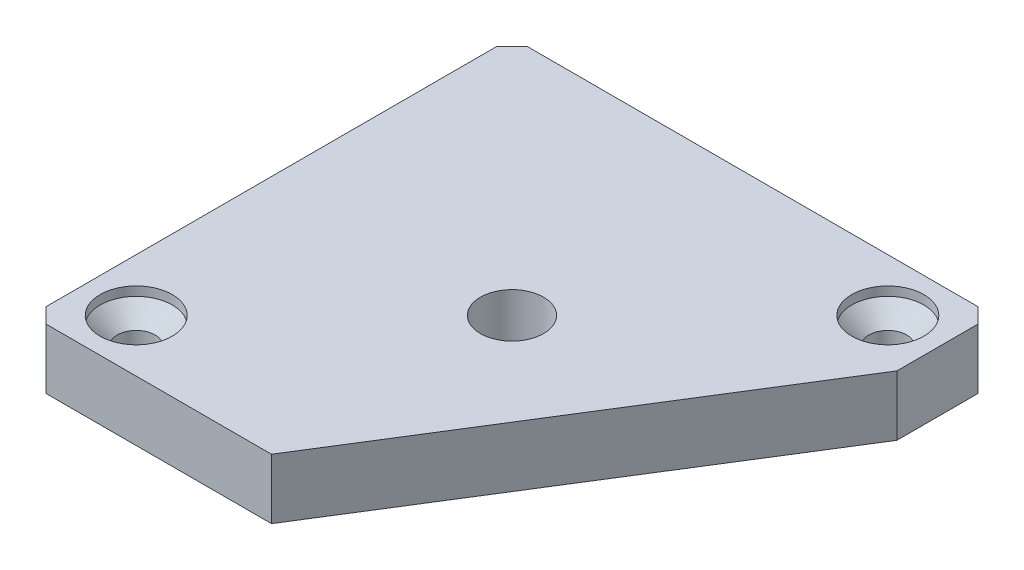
SolidWorks part; units mm, degrees
ref_plane "Plan de face" through (0, 0, 0) normal (0, 0, 1) x (1, 0, 0)
ref_plane "Plan de dessus" through (0, 0, 0) normal (0, 1, 0) x (1, 0, 0)
ref_plane "Plan de droite" through (0, 0, 0) normal (1, 0, 0) x (0, 0, -1)
sketch "Esquisse1" plane through (0, 0, 0) normal (0, 1, 0) x (1, 0, 0)
  line L1 (0, 0) -> (160, 0)
  line L2 (0, 0) -> (0, 160)
  line L3 (0, 160) -> (160, 160)
  line L4 (160, 0) -> (160, 160)
  dimension "D1" = 160
  dimension "D2" = 160
extrude "Extrusion1" add sketch "Esquisse1" along normal blind 20
other "Perçage1" parameters "D1"=20
sketch "Esquisse2" plane through (0, 20, 0) normal (0, 1, 0) x (-1, 0, 0)
  line L0 (-160, -80) -> (0, -80) construction
  line L6 (-160, 0) -> (-160, -160) construction
  line L7 (0, -160) -> (0, 0) construction
  line L8 (0, 0) -> (-160, 0) construction
  circle A0 centre (-80, -80) radius 10.5
  dimension "D1" = 21
  dimension "D2" = 80
chamfer "Chanfrein1" distance 5 angle 45 3 edges at (0, 10, -160) (160, 10, -160) (0, 10, 0)
sketch "Esquisse4" plane through (0, 20, 0) normal (0, 1, 0) x (-1, 0, 0)
  circle A0 centre (-17.5, -17.5) radius 12
  circle A1 centre (-142.5, -142.5) radius 12
  circle A2 centre (-80, -80) radius 10.5 construction
  dimension "D1" = 24
  dimension "D2" = 125
  dimension "D3" = 125
  dimension "D4" = 62.5
  dimension "D5" = 62.5
extrude "Enlèv. mat.-Extru.1" cut sketch "Esquisse4" against normal blind 3
hole_wizard "Fraisage pour vis à tête fraisée à 6 pans creux M121" positions "Esquisse3D1" profile "Esquisse5" countersink size "M12" standard "ISO"
sketch3d "Esquisse3D1"
  line L0 (17.5, 17, -17.5) -> (17.5, 20, -17.5) construction
  line L1 (142.5, 17, -142.5) -> (142.5, 20, -142.5) construction
  point P0 (17.5, 17, -17.5)
  point P4 (142.5, 17, -142.5)
sketch "Esquisse5" plane through (17.5, 17, -17.5) normal (1, 0, 0) x (0, 0, 1)
  line L0 (0, 0) -> (0, 17)
  line L1 (0, 17) -> (6.25, 17)
  line L2 (6.25, 17) -> (6.25, 5.75)
  line L3 (6.25, 5.75) -> (12, 0)
  line L5 (12, 0) -> (0, 0)
  line L6 (-6.25, 5.75) -> (-12, 0) construction
  line L11 (0, -6.35) -> (0, 107.95) construction
  dimension "Diamètre du perçage jusqu'au prochain" = 12.5
  dimension "Profondeur du perçage jusqu'au prochain" = 17
  dimension "Diamètre du fraisage entrant" = 24
  dimension "Angle du fraisage entrant" = 90
sketch "Esquisse6" plane through (0, 0, 0) normal (0, -1, 0) x (1, 0, 0)
  line L1 (0, -155) -> (0, -5) construction
  line L5 (160, 0) -> (160, -155) construction
  line L6 (80, 0) -> (160, -128.0268)
  line L7 (5, 0) -> (160, 0) construction
  line L8 (160, -128.0268) -> (160, 0)
  line L9 (80, 0) -> (160, 0)
  dimension "D3" = 80
  dimension "D4" = 32
extrude "Enlèv. mat.-Extru.2" cut sketch "Esquisse6" against normal through all
equation "\"D5@Esquisse4\" = \"D2@Esquisse4\" / 2"
equation "\"D4@Esquisse4\" = \"D3@Esquisse4\" / 2"
